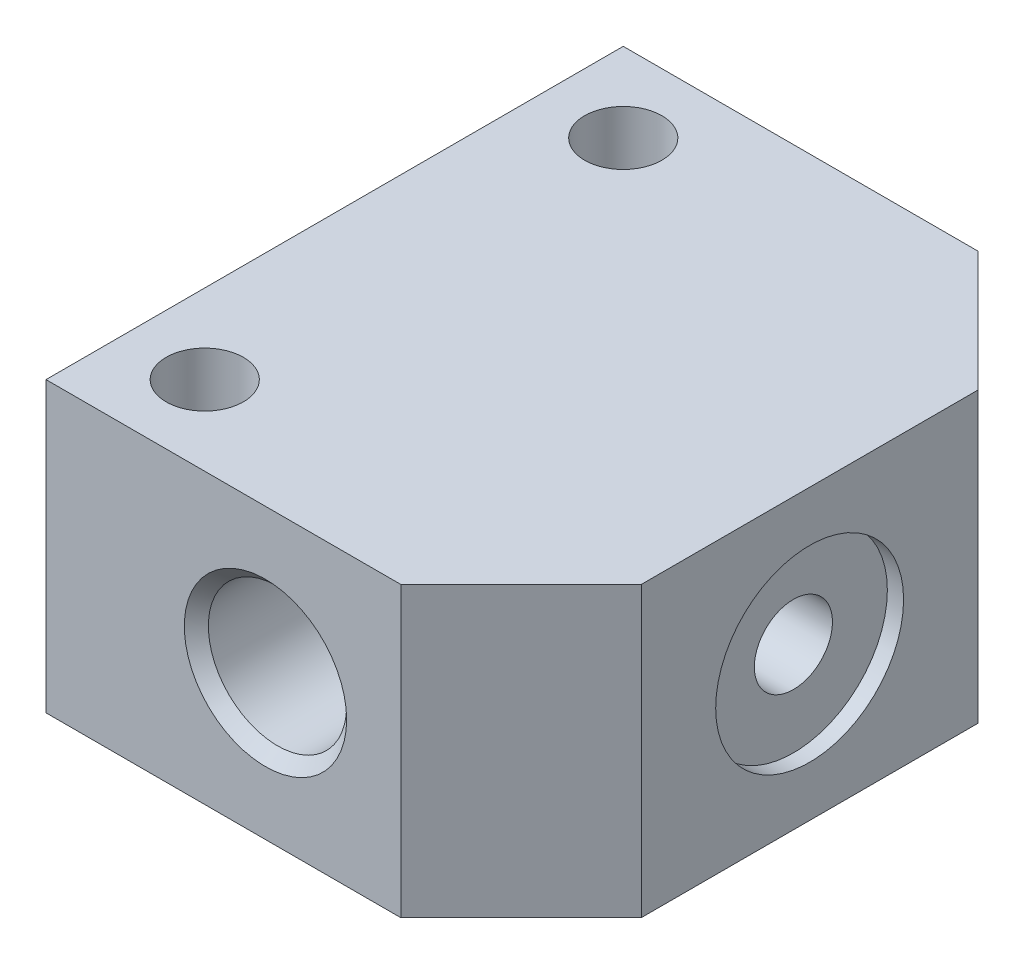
SolidWorks part; units mm, degrees
ref_plane "Front" through (0, 0, 0) normal (0, 0, 1) x (1, 0, 0)
ref_plane "Top" through (0, 0, 0) normal (0, 1, 0) x (1, 0, 0)
ref_plane "Right" through (0, 0, 0) normal (1, 0, 0) x (0, 0, -1)
sketch "Sketch1" plane through (0, 0, 0) normal (0, 0, 1) x (1, 0, 0)
  line L1 (-10.795, 6.096) -> (10.795, 6.096)
  line L2 (-10.795, 6.096) -> (-10.795, -6.096)
  line L3 (-10.795, -6.096) -> (10.795, -6.096)
  line L4 (10.795, 6.096) -> (10.795, -6.096)
  point P4 (0, -6.096)
  point P6 (-10.795, 0)
  dimension "D1" = 21.59
  dimension "D2" = 12.192
extrude "Extrude1" add sketch "Sketch1" along normal blind 24.384
sketch "Sketch4" plane through (-3.3643, 0, 0) normal (0, 0, 1) x (1, 0, 0)
  circle A0 centre (3.3643, 0) radius 2.921
  dimension "D1" = 5.842
extrude "Cut-Extrude1" cut sketch "Sketch4" along normal blind 8.89
sketch "Sketch5" plane through (51.7339, 0, 8.89) normal (0, 0, -1) x (-1, 0, 0)
  circle A0 centre (51.7339, 0) radius 1.0033
  circle A1 centre (51.7339, 0) radius 2.921 construction
  dimension "D1" = 2.0066
extrude "Cut-Extrude2" cut sketch "Sketch5" against normal through all
ref_plane "Plane1" through (0, 0, 12.192) normal (0, 0, 1) x (1, 0, 0)
fillet "Fillet1" radius 0.1778 1 edges at (2.921, 0, 8.89)
mirror "Mirror4" about plane through (0, 0, 12.192) normal (0, 0, 1) of "Fillet1", "Cut-Extrude1"
chamfer "Chamfer2" distance 0.508 angle 45 2 edges at (2.921, 0, 0) (2.921, 0, 24.384)
sketch "Sketch22" plane through (10.795, 0, 72.9583) normal (-1, 0, 0) x (0, 0, 1)
  line L0 (-72.9583, 0) -> (-48.5743, 0) construction
  line L1 (-72.9583, 6.096) -> (-72.9583, -6.096) construction
  line L2 (-48.5743, 6.096) -> (-48.5743, -6.096) construction
  circle A0 centre (-60.7663, 0) radius 1.524
  dimension "D1" = 3.048
extrude "Cut-Extrude7" cut sketch "Sketch22" along normal blind 9.8298
sketch "Sketch38" plane through (0, 0, 0) normal (0, 1, 0) x (1, 0, 0)
  line L0 (7.5463, -12.192) -> (-4.0833, -12.192) construction
  line L2 (1.0033, -13.716) -> (10.795, -13.716) construction
  line L3 (0.9652, -13.6912) -> (0.9652, -10.6928) construction
  line L4 (-0.5588, -12.192) -> (2.4892, -12.192)
  line L6 (2.9002, -10.668) -> (2.9002, -13.716) construction
  line L7 (10.795, -10.668) -> (1.0033, -10.668) construction
  line L8 (1.0033, -13.716) -> (10.795, -13.716) construction
  arc A0 (2.4892, -12.192) -> (-0.5588, -12.192) centre (0.9652, -12.192) ccw
  point P2 (2.9002, -12.192)
revolve "Cut-Revolve2" cut sketch "Sketch38" angle 360 about L0
sketch "Sketch30" plane through (10.795, 0, 72.9583) normal (-1, 0, 0) x (0, 0, 1)
  circle A0 centre (-60.7663, 0) radius 3.9688
  arc A1 (-59.2671, 0.2739) -> (-62.2655, 0.2739) centre (-60.7663, 0) ccw construction
  dimension "D1" = 7.9375
extrude "Cut-Extrude12" cut sketch "Sketch30" along normal blind 0.6858
hole_wizard "M4x0.7 Tapped Hole1" positions "Sketch32" profile "Sketch31" tap size "M4x0.7" standard "Ansi Metric"
sketch "Sketch32" plane through (10.795, 7.1948, 33.951) normal (-1, 0, 0) x (0, 0, 1)
  circle A2 centre (-21.759, -7.1948) radius 1.524 construction
  point P0 (-21.759, -7.1948)
sketch "Sketch31" plane through (10.795, 0, 12.192) normal (0, 1, 0) x (0, 0, -1)
  line L0 (0, 0) -> (0, 6.731)
  line L1 (0, 6.731) -> (1.65, 6.731)
  line L2 (1.65, 6.731) -> (1.65, 0)
  line L5 (1.65, 0) -> (0, 0)
  line L10 (0, 6.731) -> (-1.65, 6.731) construction
  line L11 (0, -6.35) -> (0, 107.95) construction
  dimension "Tap Drill Dia." = 3.3
  dimension "Tap Drill Depth" = 6.731
  dimension "Drill Angle" = 180
chamfer "Chamfer3" distance 5.08 angle 45 2 edges at (10.795, 0, 0) (10.795, 0, 24.384)
sketch "Sketch37" plane through (-10.795, 0, 0) normal (-1, 0, 0) x (0, 0, 1)
  line L1 (24.384, 6.096) -> (0, 6.096)
  line L2 (24.384, 6.096) -> (24.384, -6.096)
  line L3 (24.384, -6.096) -> (0, -6.096)
  line L4 (0, 6.096) -> (0, -6.096)
extrude "Cut-Extrude13" cut sketch "Sketch37" against normal blind 1.524
hole_wizard "#30 (0.1285) Diameter Hole1" positions "Sketch36" profile "Sketch35" hole size "#30" standard "Ansi Inch"
sketch "Sketch36" plane through (0, -6.096, 0) normal (0, -1, 0) x (1, 0, 0)
  line L1 (-9.271, 24.384) -> (5.715, 24.384) construction
  line L2 (-9.271, 0) -> (5.715, 0) construction
  line L3 (-9.271, 0) -> (-9.271, 24.384) construction
  point P0 (-5.9182, 21.0312)
  point P1 (-5.9182, 3.3528)
  dimension "os" = 3.3528
sketch "Sketch35" plane through (-5.9182, -6.096, 21.0312) normal (1, 0, 0) x (0, 0, -1)
  line L0 (0, 0) -> (0, 12.192)
  line L1 (0, 12.192) -> (1.6319, 12.192)
  line L2 (1.6319, 12.192) -> (1.6319, 0)
  line L5 (1.6319, 0) -> (0, 0)
  line L11 (0, -6.35) -> (0, 107.95) construction
  dimension "Thru Hole Dia." = 3.2639
  dimension "Thru Hole Depth" = 12.192
